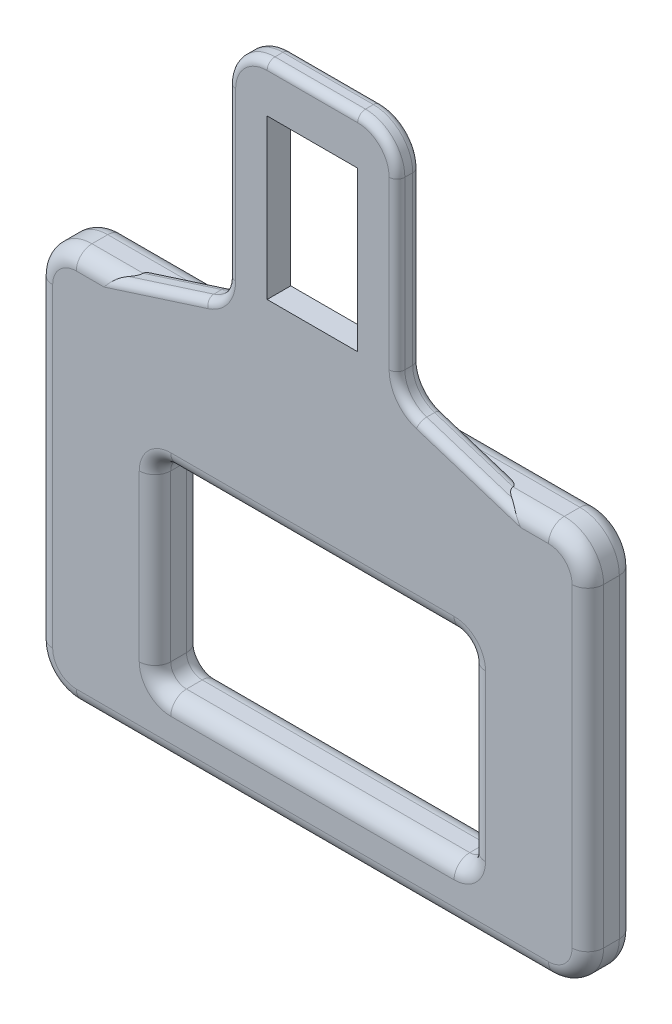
SolidWorks part; units mm, degrees
ref_plane "Ön Düzlem" through (0, 0, 0) normal (0, 0, 1) x (1, 0, 0)
ref_plane "Üst Düzlem" through (0, 0, 0) normal (0, 1, 0) x (1, 0, 0)
ref_plane "Sağ Düzlem" through (0, 0, 0) normal (1, 0, 0) x (0, 0, -1)
sketch "Çizim1" plane through (0, 0, 0) normal (0, 0, 1) x (1, 0, 0)
  line L0 (5.75, 0) -> (-5.75, 0)
  line L1 (-10.75, -5) -> (-10.75, -26.1903)
  line L2 (-13.5308, -30) -> (-23.5, -33.1903)
  line L3 (-23.5, -33.1903) -> (-23.5, -63.1903)
  line L4 (-23.5, -63.1903) -> (23.5, -63.1903)
  line L5 (0, 0) -> (0, 13.8791) construction
  line L6 (23.5, -33.1903) -> (23.5, -63.1903)
  line L7 (13.5308, -30) -> (23.5, -33.1903)
  line L8 (10.75, -5) -> (10.75, -26.1903)
  line L9 (5.75, -6) -> (-5.75, -6)
  line L10 (-5.75, -6) -> (-5.75, -26.2)
  line L11 (5.75, -6) -> (5.75, -26.2)
  line L12 (-5.75, 0) -> (-5.75, -30.3054) construction
  line L13 (10.75, -6) -> (-10.75, -6) construction
  line L14 (5.75, 0) -> (5.75, -30.3054) construction
  line L15 (5.75, -26.2) -> (-5.75, -26.2)
  line L16 (10.75, 0) -> (10.75, -30.3054) construction
  line L17 (-10.75, 0) -> (-10.75, -30.3054) construction
  line L18 (10.75, 0) -> (-10.75, 0) construction
  arc A0 (13.5308, -30) -> (10.75, -26.1903) centre (14.75, -26.1903) cw
  arc A1 (-13.5308, -30) -> (-10.75, -26.1903) centre (-14.75, -26.1903) ccw
  arc A2 (10.75, -5) -> (5.75, 0) centre (5.75, -5) ccw
  arc A3 (-10.75, -5) -> (-5.75, 0) centre (-5.75, -5) cw
  point P4 (0, 0)
  point P26 (10.75, -29.1101)
  point P30 (-10.75, -29.1101)
  dimension "D6" = 4
  dimension "D10" = 5
  dimension "D7" = 30
  dimension "D8" = 47
  dimension "D9" = 7
  dimension "D11" = 21.5
  dimension "D12" = 30
  dimension "D2" = 6
  dimension "D3" = 5
  dimension "D4" = 5
  dimension "D5" = 20.2
extrude "Yükseklik-Ekstrüzyon1" add sketch "Çizim1" along normal blind 3
sketch "Çizim2" plane through (0, 0, 3) normal (0, 0, 1) x (1, 0, 0)
  line L0 (0, 0) -> (0, -58.1903) construction
  line L2 (-30, -33.1903) -> (30, -33.1903)
  line L3 (-35, -38.1903) -> (-35, -78.1903)
  line L4 (-30, -83.1903) -> (30, -83.1903)
  line L5 (35, -38.1903) -> (35, -78.1903)
  line L6 (-35, -33.1903) -> (35, -83.1903) construction
  line L7 (-35, -83.1903) -> (35, -33.1903) construction
  line L8 (-13.5308, -30) -> (-23.5, -33.1903) construction
  line L9 (-13.5308, -30) -> (-23.5, -33.1903) construction
  arc A0 (30, -83.1903) -> (35, -78.1903) centre (30, -78.1903) ccw
  arc A1 (-35, -78.1903) -> (-30, -83.1903) centre (-30, -78.1903) ccw
  arc A2 (30, -33.1903) -> (35, -38.1903) centre (30, -38.1903) cw
  arc A3 (-30, -33.1903) -> (-35, -38.1903) centre (-30, -38.1903) ccw
  dimension "D3" = 5
  dimension "D1" = 70
  dimension "D2" = 50
extrude "Yükseklik-Ekstrüzyon2" add sketch "Çizim2" against normal blind 6
fillet "Radyus1" radius 2 8 edges at (33.5355, -34.6548, -3) (35, -58.1903, -3) (33.5355, -81.7259, -3) (0, -83.1903, -3) (-33.5355, -81.7259, -3) (-35, -58.1903, -3) (-33.5355, -34.6548, -3) (0, -33.1903, -3)
fillet "Radyus2" radius 1 18 edges at (18.5154, -31.5952, 3) (11.5192, -28.5486, 3) (10.75, -15.5952, 3) (9.2855, -1.4645, 3) (0, 0, 3) (-18.5154, -31.5952, 3) (-11.5192, -28.5486, 3) (-10.75, -15.5952, 3) (18.5154, -31.5952, 0) (11.5192, -28.5486, 0) (10.75, -15.5952, 0) (9.2855, -1.4645, 0) (0, 0, 0) (-18.5154, -31.5952, 0) (-11.5192, -28.5486, 0) (-10.75, -15.5952, 0) (-9.2855, -1.4645, 3) (-9.2855, -1.4645, 0)
fillet "Radyus3" radius 2 9 edges at (-25.1095, -33.1903, 3) (-33.5355, -34.6548, 3) (25.1095, -33.1903, 3) (33.5355, -34.6548, 3) (35, -58.1903, 3) (33.5355, -81.7259, 3) (0, -83.1903, 3) (-33.5355, -81.7259, 3) (-35, -58.1903, 3)
sketch "Çizim3" plane through (0, 0, -3) normal (0, 0, -1) x (-1, 0, 0)
  line L0 (0, 0) -> (0, -63.6903) construction
  line L1 (30, -83.1903) -> (-30, -83.1903) construction
  line L2 (-20, -76.1903) -> (20, -76.1903)
  line L3 (-20, -76.1903) -> (-20, -51.1903)
  line L4 (-20, -51.1903) -> (20, -51.1903)
  line L5 (20, -76.1903) -> (20, -51.1903)
  line L6 (-20, -76.1903) -> (20, -51.1903) construction
  line L7 (-20, -51.1903) -> (20, -76.1903) construction
  dimension "D1" = 40
  dimension "D2" = 25
  dimension "D3" = 7
extrude "Kes-Ekstrüzyon1" cut sketch "Çizim3" against normal through all
fillet "Radyus4" radius 2 12 edges at (20, -63.6903, 3) (20, -63.6903, -3) (-20, -63.6903, 3) (-20, -63.6903, -3) (-20, -51.1903, 0) (0, -51.1903, 3) (20, -51.1903, 0) (0, -51.1903, -3) (20, -76.1903, 0) (0, -76.1903, 3) (-20, -76.1903, 0) (0, -76.1903, -3)
sketch "Çizim4" [suppressed] plane through (0, 0, -3) normal (0, 0, -1) x (-1, 0, 0)
  line L0 (-20, -51.1903) -> (-20, -25.2644)
  line L1 (-20, -53.1903) -> (-20, -74.1903) construction
  line L2 (-20, -25.2644) -> (-42.4028, -25.2644)
  line L3 (-42.4028, -25.2644) -> (-42.4028, -87.7225)
  line L4 (-42.4028, -87.7225) -> (38.6209, -87.7225)
  line L5 (38.6209, -87.7225) -> (38.6209, -25.2644)
  line L6 (38.6209, -25.2644) -> (20, -25.2644)
  line L7 (20, -25.2644) -> (20, -51.1903)
  line L8 (20, -51.1903) -> (-20, -51.1903)
  line L9 (18, -51.1903) -> (-18, -51.1903) construction
extrude "Kes-Ekstrüzyon2" [suppressed] cut sketch "Çizim4" against normal through all
fillet "Radyus5" [suppressed] radius 1
